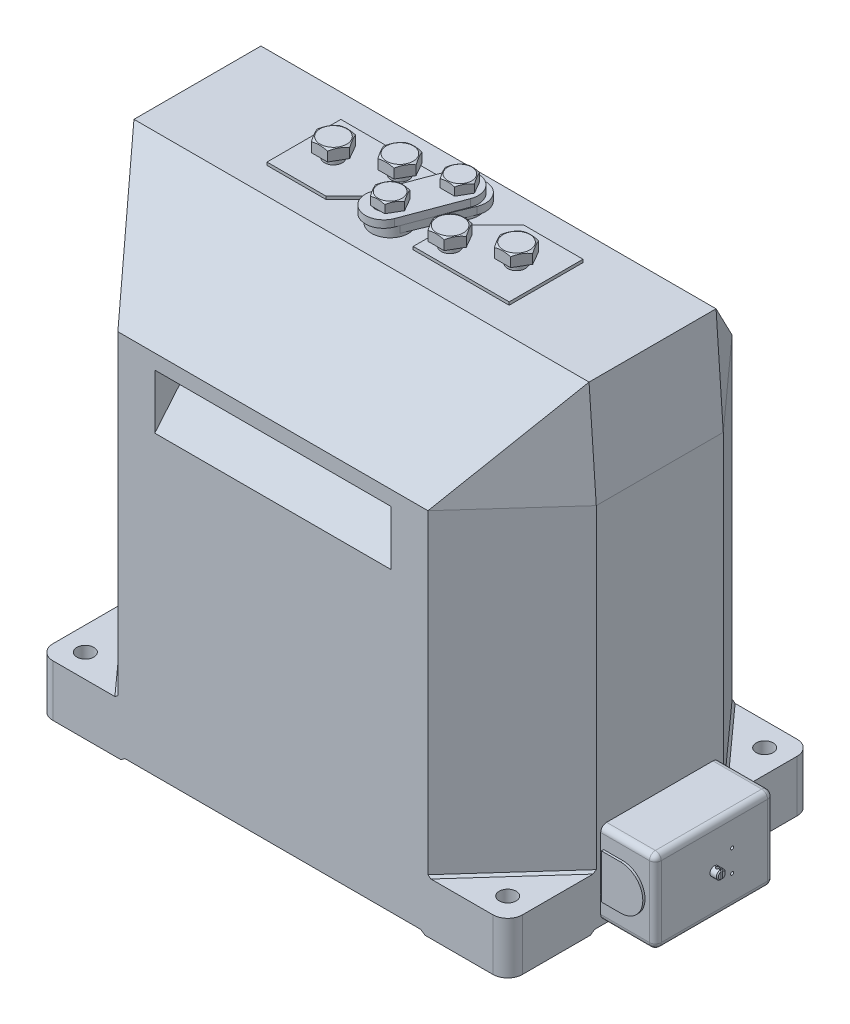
SolidWorks part; units mm, degrees
ref_plane "Front Plane" through (0, 0, 0) normal (0, 0, 1) x (1, 0, 0)
ref_plane "Top Plane" through (0, 0, 0) normal (0, 1, 0) x (1, 0, 0)
ref_plane "Right Plane" through (0, 0, 0) normal (1, 0, 0) x (0, 0, -1)
other "Join1"
other "HlTmCsDIN933<7>@24305_AM-40a_Körvonalrajzhoz"
other "HlTmCsDIN933<6>@24305_AM-40a_Körvonalrajzhoz"
other "HlTmCsDIN933<5>@24305_AM-40a_Körvonalrajzhoz"
other "HlTmCsDIN933<4>@24305_AM-40a_Körvonalrajzhoz"
other "HlTmCsDIN933<3>@24305_AM-40a_Körvonalrajzhoz"
other "HlTmCsDIN933<2>@24305_AM-40a_Körvonalrajzhoz"
other "24205-124_ÁtkötőLamella<2>@24305_AM-40a_Körvonalrajzhoz"
other "24205-124_ÁtkötőLamella<1>@24305_AM-40a_Körvonalrajzhoz"
other "HlTmCsDIN933<1>@24305_AM-40a_Körvonalrajzhoz"
other "AM40a_TRA_Kiöntött_Körvonalrajzhoz<1>@24305_AM-40a_Körvonalrajzhoz/AM40a_TRA_Test_T24305<1>@AM40a_TRA_Kiöntött_Körvonalrajzhoz"
other "21105-115_PlombaCsavar<1>@24305_AM-40a_Körvonalrajzhoz"
other "FME12_Tömszelence_29519_112<2>@24305_AM-40a_Körvonalrajzhoz"
other "FME12_Tömszelence_29519_112<1>@24305_AM-40a_Körvonalrajzhoz"
other "FME12_TRA_Kapocsfedél_29519_113<1>@24305_AM-40a_Körvonalrajzhoz"
